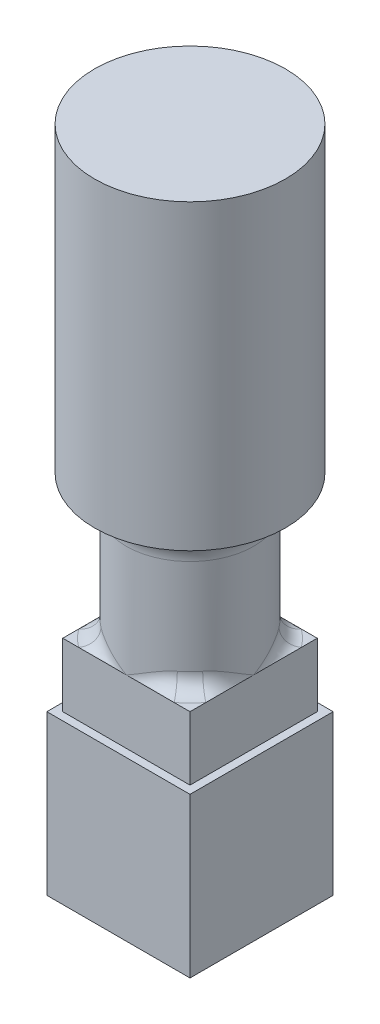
SolidWorks part; units mm, degrees
ref_plane "Alzado" through (0, 0, 0) normal (0, 0, 1) x (1, 0, 0)
ref_plane "Planta" through (0, 0, 0) normal (0, 1, 0) x (1, 0, 0)
ref_plane "Vista lateral" through (0, 0, 0) normal (1, 0, 0) x (0, 0, -1)
sketch "Croquis2" plane through (0, 0, 0) normal (0, 1, 0) x (1, 0, 0)
  circle A0 centre (0, 0) radius 30
  dimension "D1" = 60
extrude "Saliente-Extruir1" add sketch "Croquis2" against normal blind 95
sketch "Croquis3" plane through (0, -95, 0) normal (0, -1, 0) x (1, 0, 0)
  circle A0 centre (0, 0) radius 20
  dimension "D1" = 40
extrude "Saliente-Extruir2" add sketch "Croquis3" along normal blind 45
fillet "Redondeo1" radius 10 1 edges at (0, -95, 20)
sketch "Croquis4" plane through (0, -140, 0) normal (0, -1, 0) x (1, 0, 0)
  line L0 (33, 0) -> (-33, 0) construction
  line L1 (-20, 20) -> (20, 20)
  line L2 (-20, 20) -> (-20, -20)
  line L3 (-20, -20) -> (20, -20)
  line L4 (20, 20) -> (20, -20)
  line L5 (0, -33) -> (0, 33) construction
  dimension "D1" = 40
  dimension "D2" = 40
  dimension "D3" = 20
  dimension "D4" = 20
extrude "Saliente-Extruir3" add sketch "Croquis4" along normal blind 20
fillet "Redondeo3" radius 5 4 edges at (14.1421, -140, -14.1421) (-14.1421, -140, -14.1421) (-14.1421, -140, 14.1421) (14.1421, -140, 14.1421)
sketch "Croquis5" plane through (0, -160, 0) normal (0, -1, 0) x (1, 0, 0)
  line L0 (33, 0) -> (-33, 0) construction
  line L1 (-22.5, 22.5) -> (22.5, 22.5)
  line L2 (-22.5, 22.5) -> (-22.5, -22.5)
  line L3 (-22.5, -22.5) -> (22.5, -22.5)
  line L4 (22.5, 22.5) -> (22.5, -22.5)
  line L5 (0, -33) -> (0, 33) construction
  dimension "D1" = 45
  dimension "D2" = 45
  dimension "D3" = 22.5
  dimension "D4" = 22.5
extrude "Saliente-Extruir4" add sketch "Croquis5" along normal blind 50
